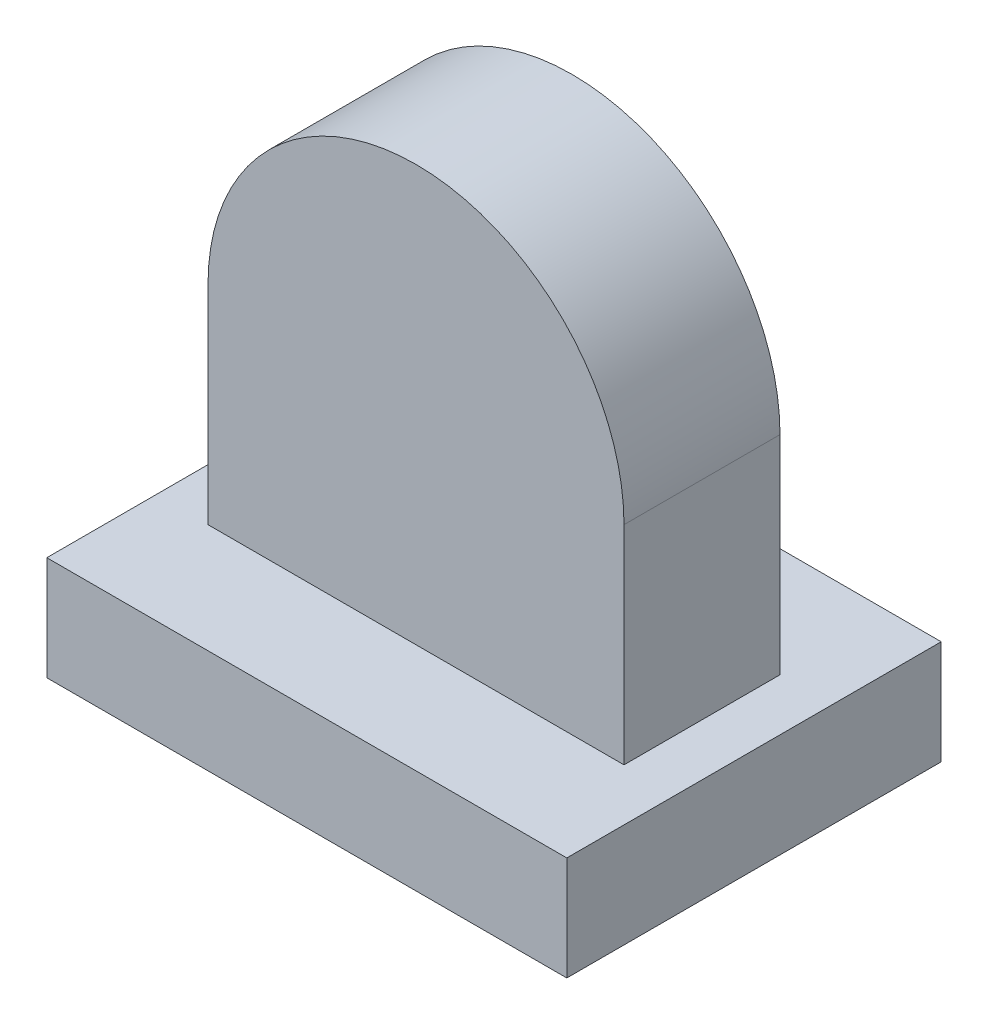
SolidWorks part; units mm, degrees
ref_plane "前视基准面" through (0, 0, 0) normal (0, 0, 1) x (1, 0, 0)
ref_plane "上视基准面" through (0, 0, 0) normal (0, 1, 0) x (1, 0, 0)
ref_plane "右视基准面" through (0, 0, 0) normal (1, 0, 0) x (0, 0, -1)
sketch "草图1" plane through (0, 0, 0) normal (0, 1, 0) x (1, 0, 0)
  line L1 (-25, 18) -> (25, 18)
  line L2 (-25, 18) -> (-25, -18)
  line L3 (-25, -18) -> (25, -18)
  line L4 (25, 18) -> (25, -18)
  line L5 (-25, 18) -> (25, -18) construction
  line L6 (-25, -18) -> (25, 18) construction
  point P0 (0, 0)
  dimension "D1" = 50
  dimension "D2" = 36
extrude "凸台-拉伸1" add sketch "草图1" along normal blind 10
sketch "草图3" plane through (0, 0, 0) normal (0, 0, 1) x (1, 0, 0)
  line L0 (0, -4.3584) -> (0, 47.1889) construction
  line L1 (-21.1938, 30) -> (13.2013, 30) construction
  line L2 (20, 30) -> (20, 10)
  line L3 (-25, 10) -> (25, 10) construction
  line L4 (-20, 30) -> (-20, 10)
  line L5 (-20, 10) -> (20, 10)
  arc A0 (20, 30) -> (-20, 30) centre (0, 30) ccw
  dimension "D1" = 20
  dimension "D2" = 20
extrude "凸台-拉伸2" add sketch "草图3" along normal mid plane 15
